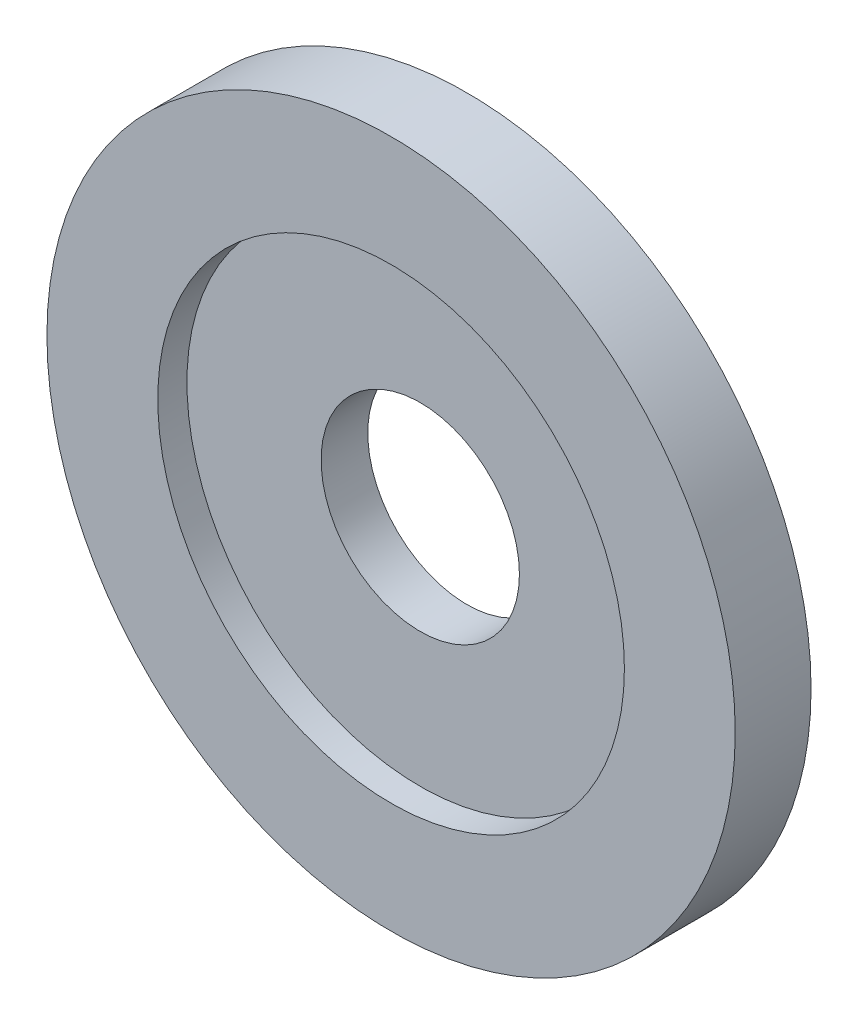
SolidWorks part; units mm, degrees
ref_plane "Plan de face" through (0, 0, 0) normal (0, 0, 1) x (1, 0, 0)
ref_plane "Plan de dessus" through (0, 0, 0) normal (0, 1, 0) x (1, 0, 0)
ref_plane "Plan de droite" through (0, 0, 0) normal (1, 0, 0) x (0, 0, -1)
sketch "Esquisse1" plane through (0, 0, 0) normal (0, 0, 1) x (1, 0, 0)
  circle A0 centre (0, 0) radius 29.5
  dimension "D1" = 59
extrude "Extrusion1" add sketch "Esquisse1" along normal blind 6.5
hole_wizard "Perçage1" positions "Esquisse4" profile "Esquisse5" legacy
sketch "Esquisse4" plane through (0, 0, 6.5) normal (0, 0, 1) x (1, 0, 0)
  point P0 (0, 0)
sketch "Esquisse5" plane through (0, 0, 6.5) normal (1, 0, 0) x (0, -1, 0)
  line L0 (0, 0) -> (0, 15)
  line L1 (0, 15) -> (8.5, 15)
  line L2 (8.5, 15) -> (8.5, 2.5)
  line L3 (8.5, 2.5) -> (20, 2.5)
  line L4 (20, 2.5) -> (20, 0)
  line L5 (20, 0) -> (0, 0)
  line L6 (0, 110) -> (0, -10) construction
  dimension "Diamètre" = 17
  dimension "Profondeur" = 15
  dimension "Diamètre chambrage" = 40
  dimension "Profondeur chambrage" = 2.5
